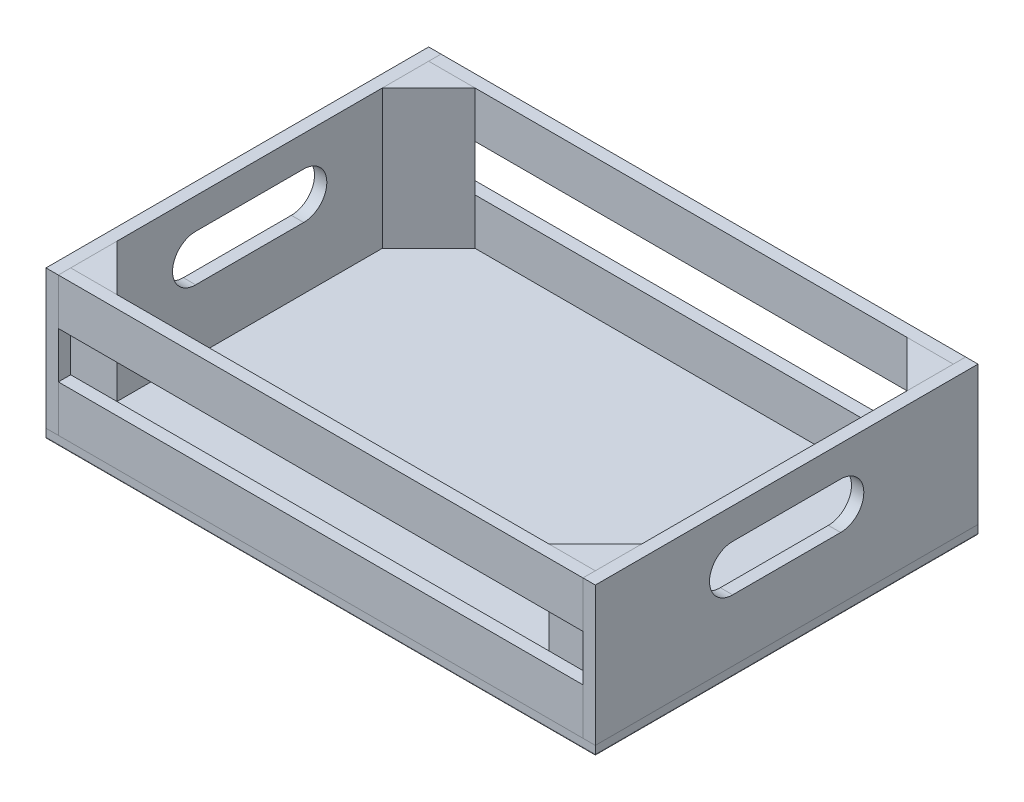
SolidWorks part; units mm, degrees
ref_plane "Front Plane" through (0, 0, 0) normal (0, 0, 1) x (1, 0, 0)
ref_plane "Top Plane" through (0, 0, 0) normal (0, 1, 0) x (1, 0, 0)
ref_plane "Right Plane" through (0, 0, 0) normal (1, 0, 0) x (0, 0, -1)
sketch "Sketch1" plane through (0, 0, 0) normal (0, 0, 1) x (1, 0, 0)
  line L0 (-85, 0) -> (-85, 45) construction
  line L1 (-85, 0) -> (85, 0)
  line L2 (-85, 0) -> (-85, 15)
  line L3 (-85, 15) -> (85, 15)
  line L4 (85, 0) -> (85, 15)
  line L5 (-85, 30) -> (-85, 45)
  line L6 (-85, 30) -> (85, 30)
  line L7 (85, 30) -> (85, 45)
  line L8 (-85, 45) -> (85, 45)
  dimension "D1" = 15
  dimension "D2" = 170
  dimension "D3" = 15
extrude "Boss-Extrude1" add sketch "Sketch1" along normal blind 4
move or copy body "Body-Move/Copy1" bodies to move or copy 102 101 copy yes number of copies 1 translate (0, 0, -120)
sketch "Sketch6" plane through (-85, 0, 0) normal (-1, 0, 0) x (0, 0, 1)
  line L0 (-75.5, 27.5) -> (-40.5, 27.5) construction
  line L1 (-120, 45) -> (4, 45)
  line L2 (-120, 45) -> (-120, 0)
  line L3 (-120, 0) -> (4, 0)
  line L4 (4, 45) -> (4, 0)
  line L5 (-75.5, 35) -> (-40.5, 35)
  line L6 (-75.5, 20) -> (-40.5, 20)
  arc A0 (-75.5, 35) -> (-75.5, 20) centre (-75.5, 27.5) ccw
  arc A1 (-40.5, 20) -> (-40.5, 35) centre (-40.5, 27.5) ccw
  point P8 (-58, 27.5)
  point P14 (-58, 45)
  dimension "D2" = 7.5
  dimension "D1" = 35
  dimension "D3" = 10
extrude "Boss-Extrude2" add sketch "Sketch6" along normal blind 4 separate body
mirror "Mirror2" about plane through (0, 0, 0) normal (1, 0, 0)
sketch "Sketch8" plane through (0, 0, 0) normal (0, -1, 0) x (1, 0, 0)
  line L1 (-89, 4) -> (89, 4)
  line L2 (-89, 4) -> (-89, -120)
  line L3 (-89, -120) -> (89, -120)
  line L4 (89, 4) -> (89, -120)
extrude "Boss-Extrude4" add sketch "Sketch8" along normal blind 3 separate body
fillet "Fillet2" radius 0.5 4 edges at (0, -3, 4) (89, -3, -58) (0, -3, -120) (-89, -3, -58)
sketch "Sketch9" plane through (0, 0, 0) normal (0, 1, 0) x (1, 0, 0)
  line L0 (-85, 116) -> (-85, 101)
  line L1 (-85, -4) -> (-85, 120) construction
  line L2 (-85, 101) -> (-70, 116)
  line L3 (85, 116) -> (-85, 116) construction
  line L4 (-70, 116) -> (-85, 116)
  dimension "D1" = 15
  dimension "D2" = 15
extrude "Boss-Extrude5" add sketch "Sketch9" along normal up to vertex separate body
mirror "Mirror3" about plane through (0, 0, 0) normal (1, 0, 0)
ref_plane "Plane1" through (0, 0, -58) normal (0, 0, 1) x (1, 0, 0)
mirror "Mirror4" about plane through (0, 0, -58) normal (0, 0, 1)
